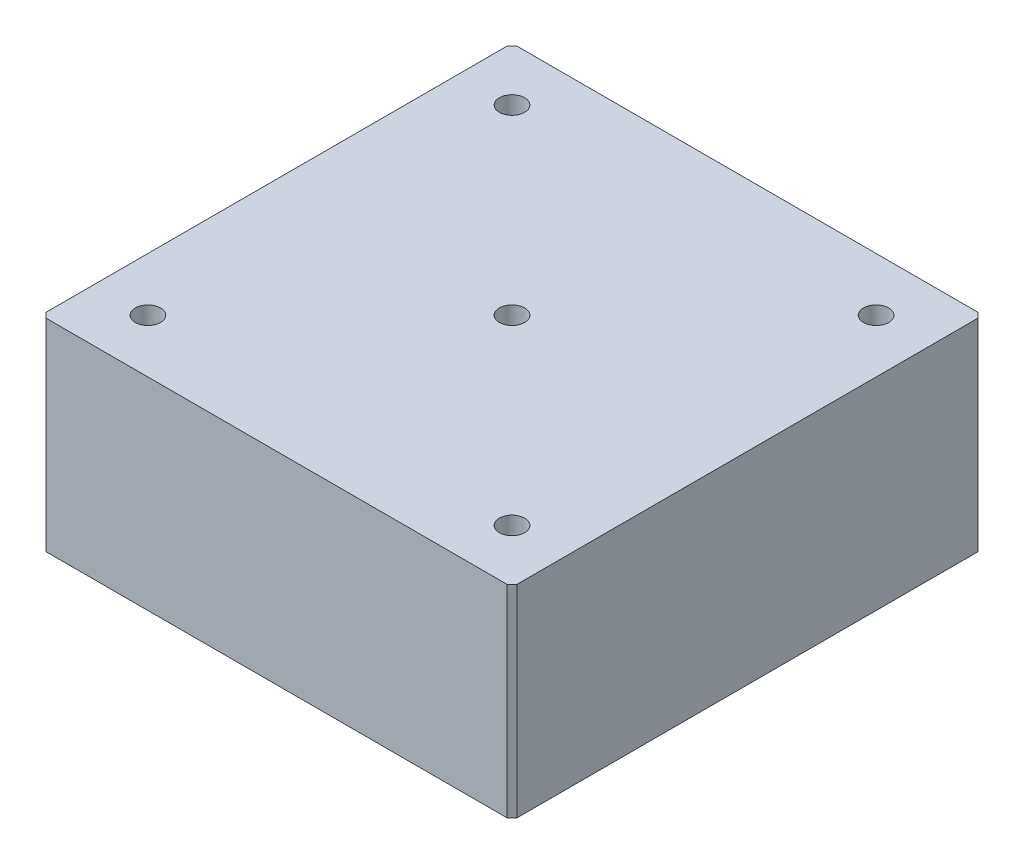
SolidWorks part; units mm, degrees
ref_plane "Front" through (0, 0, 0) normal (0, 0, 1) x (1, 0, 0)
ref_plane "Top" through (0, 0, 0) normal (0, 1, 0) x (1, 0, 0)
ref_plane "Right" through (0, 0, 0) normal (1, 0, 0) x (0, 0, -1)
sketch "Sketch1" plane through (0, 0, 0) normal (0, 1, 0) x (1, 0, 0)
  line L1 (-147.8839, -147.8839) -> (147.8839, -147.8839)
  line L2 (-147.8839, -147.8839) -> (-147.8839, 147.8839)
  line L3 (-147.8839, 147.8839) -> (147.8839, 147.8839)
  line L4 (147.8839, -147.8839) -> (147.8839, 147.8839)
  line L5 (-147.8839, -147.8839) -> (147.8839, 147.8839) construction
  line L6 (-147.8839, 147.8839) -> (147.8839, -147.8839) construction
  point P0 (0, 0)
  dimension "D1" = 295.7678
extrude "Boss-Extrude1" add sketch "Sketch1" against normal mid plane 127
hole_wizard "1/4 Clearance Hole1" positions "Sketch3" profile "Sketch2" hole size "1/4" standard "Ansi Inch"
sketch "Sketch3" plane through (0, 63.5, 0) normal (0, 1, 0) x (-1, 0, 0)
  line L1 (127, 127) -> (-127, 127)
  line L2 (127, 127) -> (127, -127)
  line L3 (127, -127) -> (-127, -127)
  line L4 (-127, 127) -> (-127, -127)
  line L5 (127, 127) -> (-127, -127) construction
  line L6 (127, -127) -> (-127, 127) construction
  point P0 (127, -127)
  point P1 (0, -127)
  point P3 (-127, -127)
  point P5 (-127, 0)
  point P7 (-127, 127)
  point P9 (0, 127)
  point P11 (127, 127)
  point P13 (127, 0)
  point P15 (0, 0)
  point P19 (0, 0)
  dimension "D1" = 254
sketch "Sketch2" plane through (-127, 63.5, -127) normal (1, 0, 0) x (0, 0, 1)
  line L0 (0, 0) -> (0, 127)
  line L1 (0, 127) -> (3.3782, 127)
  line L2 (3.3782, 127) -> (3.3782, 0)
  line L5 (3.3782, 0) -> (0, 0)
  line L11 (0, -6.35) -> (0, 107.95) construction
  dimension "Thru Hole Dia." = 6.7564
  dimension "Thru Hole Depth" = 127
chamfer "Chamfer1" distance 3.175 angle 45 4 edges at (-147.8839, 0, 147.8839) (147.8839, 0, 147.8839) (147.8839, 0, -147.8839) (-147.8839, 0, -147.8839)
hole_wizard "CBORE for 1/4 Hex Machine Screw2" positions "Sketch9" profile "Sketch8" counterbore size "1/4" standard "Ansi Inch"
sketch "Sketch9" plane through (0, 63.5, 0) normal (0, 1, 0) x (-1, 0, 0)
  circle A0 centre (-114.3, -114.3) radius 3.3782 construction
  circle A2 centre (114.3, -114.3) radius 3.3782 construction
  circle A4 centre (0, 0) radius 3.3782 construction
  circle A6 centre (114.3, 114.3) radius 3.3782 construction
  circle A8 centre (-114.3, 114.3) radius 3.3782 construction
  circle A9 centre (-114.3, -114.3) radius 3.3782
  circle A11 centre (114.3, -114.3) radius 3.3782
  circle A13 centre (0, 0) radius 3.3782
  circle A15 centre (114.3, 114.3) radius 3.3782
  circle A17 centre (-114.3, 114.3) radius 3.3782
  point P0 (-114.3, -114.3)
  point P3 (-114.3, 114.3)
  point P7 (0, 0)
  point P11 (114.3, -114.3)
  point P15 (114.3, 114.3)
sketch "Sketch8" plane through (114.3, 63.5, -114.3) normal (1, 0, 0) x (0, 0, 1)
  line L0 (0, 0) -> (0, 127)
  line L1 (0, 127) -> (3.3782, 127)
  line L3 (3.3782, 127) -> (3.3782, 74.676)
  line L4 (3.3782, 74.676) -> (7.9375, 74.676)
  line L5 (7.9375, 74.676) -> (7.9375, 0)
  line L7 (7.9375, 0) -> (0, 0)
  line L11 (0, -6.35) -> (0, 107.95) construction
  dimension "Thru Hole Dia." = 6.7564
  dimension "Thru Hole Depth" = 127
  dimension "C'Bore Dia." = 15.875
  dimension "C'Bore Depth" = 74.676
